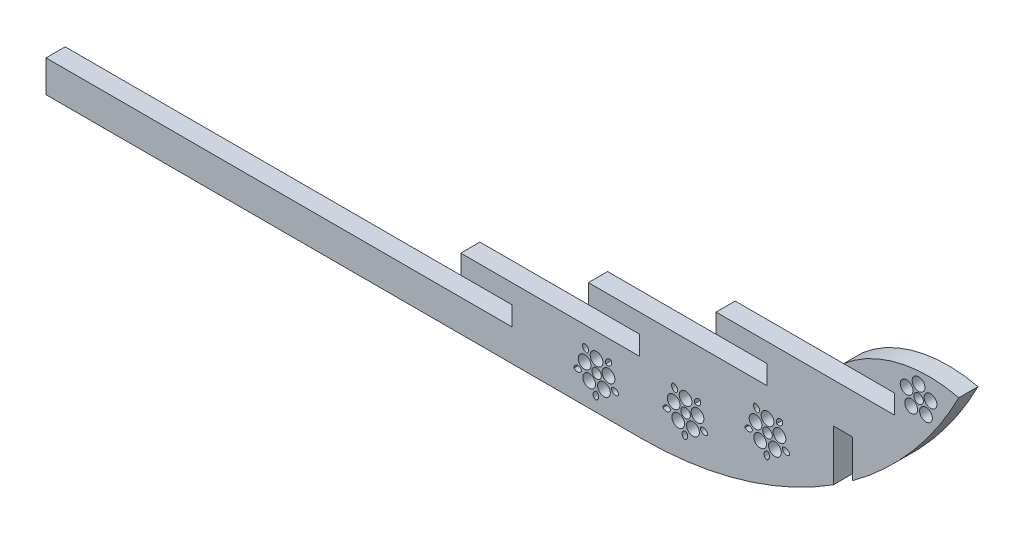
SolidWorks part; units mm, degrees
ref_plane "Front Plane" through (0, 0, 0) normal (0, 0, 1) x (1, 0, 0)
ref_plane "Top Plane" through (0, 0, 0) normal (0, 1, 0) x (1, 0, 0)
ref_plane "Right Plane" through (0, 0, 0) normal (1, 0, 0) x (0, 0, -1)
sketch "Sketch1" plane through (0, 0, 0) normal (0, 0, 1) x (1, 0, 0)
  line L0 (-25.3989, -4.5384) -> (-25.3989, -7.5384)
  line L1 (-33.3989, -1.5384) -> (-5.3989, -1.5384)
  line L2 (-33.3989, -1.5384) -> (-33.3989, -4.5384)
  line L3 (-33.3989, -4.5384) -> (-25.3989, -4.5384)
  line L4 (-5.3989, 1.4616) -> (-13.3989, 1.4616)
  line L5 (-53.3989, -7.5384) -> (-25.3989, -7.5384)
  line L6 (-53.3989, -7.5384) -> (-53.3989, -10.5384)
  line L7 (-53.3989, -10.5384) -> (-45.3989, -10.5384)
  line L9 (-73.3989, -13.5384) -> (-45.3989, -13.5384)
  line L10 (-73.3989, -13.5384) -> (-73.3989, -16.5384)
  line L11 (-73.3989, -16.5384) -> (-65.3989, -16.5384)
  line L12 (-15.0158, -7.7921) -> (-12.0158, -7.7921)
  line L13 (-138.3989, -19.5384) -> (-65.3989, -19.5384)
  line L14 (-138.3989, -19.5384) -> (-138.3989, -24.5384)
  line L15 (-138.3989, -24.5384) -> (-44.9892, -24.5384)
  line L16 (-15.0158, -7.7921) -> (-15.0156, -15.7921)
  line L17 (-45.3989, -10.5384) -> (-45.3989, -13.5384)
  line L18 (-65.3989, -16.5384) -> (-65.3989, -19.5384)
  line L20 (-12.0158, -7.7921) -> (-12.0157, -13.7377)
  line L24 (-5.3989, 1.4616) -> (-5.3989, -1.5384)
  arc A0 (-13.3989, 1.4616) -> (4.6546, 5.8637) centre (-0.0601, -14.0217) cw
  arc A1 (-44.9892, -24.5384) -> (-15.0156, -15.7921) centre (-44.9892, 31.1945) ccw
  arc A2 (-12.0157, -13.7377) -> (4.6546, 5.8637) centre (-44.9892, 31.1945) ccw
  circle A3 centre (-1.6595, 2.5939) radius 0.75
  circle A4 centre (-38.1711, -17.6173) radius 0.75
  circle A5 centre (-1.6595, 4.5633) radius 1
  circle A6 centre (0.2135, 3.2025) radius 1
  circle A7 centre (-0.5019, 1.0007) radius 1
  circle A8 centre (-2.817, 1.0007) radius 1
  circle A9 centre (-3.5324, 3.2025) radius 1
  arc A20 (-36.7361, -15.6155) -> (-35.9087, -14.7003) centre (-36.091, -15.3671) cw
  arc A21 (-39.6315, -15.634) -> (-40.2462, -14.5643) centre (-39.6684, -14.9437) cw
  circle A22 centre (-39.3286, -19.2106) radius 1
  arc A23 (-38.2868, -21.307) -> (-38.1554, -20.0803) centre (-38.0807, -20.7087) cw
  arc A24 (-35.9087, -14.7003) -> (-36.7361, -15.6155) centre (-36.4272, -15.0632) cw
  arc A25 (-35.8238, -18.3635) -> (-34.6977, -18.8675) centre (-35.3882, -18.9002) cw
  arc A26 (-40.5087, -18.3933) -> (-41.716, -18.6475) centre (-41.1766, -18.2152) cw
  circle A27 centre (-38.1711, -15.648) radius 1
  circle A28 centre (-40.044, -17.0088) radius 1
  arc A29 (-34.6977, -18.8675) -> (-35.8238, -18.3635) centre (-35.2031, -18.4866) cw
  arc A30 (-38.1554, -20.0803) -> (-38.2868, -21.307) centre (-38.5313, -20.6605) cw
  arc A31 (-40.2462, -14.5643) -> (-39.6315, -15.634) centre (-40.0613, -15.1695) cw
  circle A32 centre (-36.2981, -17.0088) radius 1
  circle A33 centre (-37.0135, -19.2106) radius 1
  arc A34 (-41.716, -18.6475) -> (-40.5087, -18.3933) centre (-41.0832, -18.6586) cw
  arc A35 (-27.6687, -14.7037) -> (-28.876, -14.9578) centre (-28.3366, -14.5255) cw
  arc A36 (-21.8577, -15.1779) -> (-22.9838, -14.6738) centre (-22.3631, -14.7969) cw
  circle A37 centre (-24.1736, -15.5209) radius 1
  arc A38 (-25.3154, -16.3906) -> (-25.4468, -17.6173) centre (-25.6913, -16.9708) cw
  circle A39 centre (-26.4887, -15.5209) radius 1
  arc A40 (-22.9838, -14.6738) -> (-21.8577, -15.1779) centre (-22.5482, -15.2106) cw
  circle A41 centre (-25.3311, -13.9276) radius 0.75
  circle A42 centre (-23.4582, -13.3191) radius 1
  arc A43 (-28.876, -14.9578) -> (-27.6687, -14.7037) centre (-28.2432, -14.9689) cw
  arc A44 (-23.8961, -11.9258) -> (-23.0688, -11.0106) centre (-23.251, -11.6774) cw
  arc A45 (-26.7915, -11.9443) -> (-27.4063, -10.8746) centre (-26.8284, -11.254) cw
  arc A46 (-23.0688, -11.0106) -> (-23.8961, -11.9258) centre (-23.5872, -11.3735) cw
  circle A47 centre (-27.2041, -13.3191) radius 1
  circle A48 centre (-25.3311, -11.9583) radius 1
  arc A49 (-27.4063, -10.8746) -> (-26.7915, -11.9443) centre (-27.2213, -11.4798) cw
  arc A50 (-25.4468, -17.6173) -> (-25.3154, -16.3906) centre (-25.2407, -17.019) cw
  circle A51 centre (-52.1194, -17.2412) radius 1
  arc A52 (-55.6643, -20.2407) -> (-54.457, -19.9866) centre (-55.0316, -20.2518) cw
  circle A53 centre (-50.2465, -18.602) radius 1
  arc A54 (-52.2351, -22.9003) -> (-52.1038, -21.6735) centre (-52.029, -22.3019) cw
  arc A55 (-53.5798, -17.2272) -> (-54.1946, -16.1575) centre (-53.6168, -16.5369) cw
  circle A56 centre (-50.9619, -20.8038) radius 1
  circle A57 centre (-53.277, -20.8038) radius 1
  circle A58 centre (-53.9924, -18.602) radius 1
  arc A59 (-54.457, -19.9866) -> (-55.6643, -20.2407) centre (-55.1249, -19.8084) cw
  arc A60 (-48.6461, -20.4608) -> (-49.7722, -19.9568) centre (-49.1514, -20.0799) cw
  circle A61 centre (-52.1194, -19.2106) radius 0.75
  arc A62 (-49.7722, -19.9568) -> (-48.6461, -20.4608) centre (-49.3366, -20.4935) cw
  arc A63 (-52.1038, -21.6735) -> (-52.2351, -22.9003) centre (-52.4796, -22.2537) cw
  arc A64 (-50.6844, -17.2088) -> (-49.8571, -16.2935) centre (-50.0394, -16.9603) cw
  arc A65 (-54.1946, -16.1575) -> (-53.5798, -17.2272) centre (-54.0096, -16.7627) cw
  arc A66 (-49.8571, -16.2935) -> (-50.6844, -17.2088) centre (-50.3755, -16.6565) cw
  point P42 (-1.6595, 2.5939)
  point P63 (-1.6595, 2.5939)
  point P74 (-38.1711, -17.6173)
  point P92 (-38.1711, -17.6173)
  point P108 (-25.3311, -13.9276)
  point P126 (-25.3311, -13.9276)
  point P142 (-52.1194, -19.2106)
  point P160 (-52.1194, -19.2106)
  dimension "D5" = 3
  dimension "D9" = 20
  dimension "D17" = 65
  dimension "D20" = 1.5
  dimension "D21" = 2
  dimension "D2" = 8
  dimension "D3" = 3
  dimension "D4" = 3
  dimension "D6" = 3
  dimension "D7" = 3
  dimension "D8" = 3
  dimension "D10" = 8
  dimension "D11" = 8
  dimension "D12" = 8
  dimension "D13" = 8
  dimension "D14" = 3
  dimension "D15" = 20
  dimension "D16" = 20
  dimension "D18" = 5
  dimension "D19" = 3
  dimension "D22" = 5
extrude "Boss-Extrude1" add sketch "Sketch1" along normal blind 3
